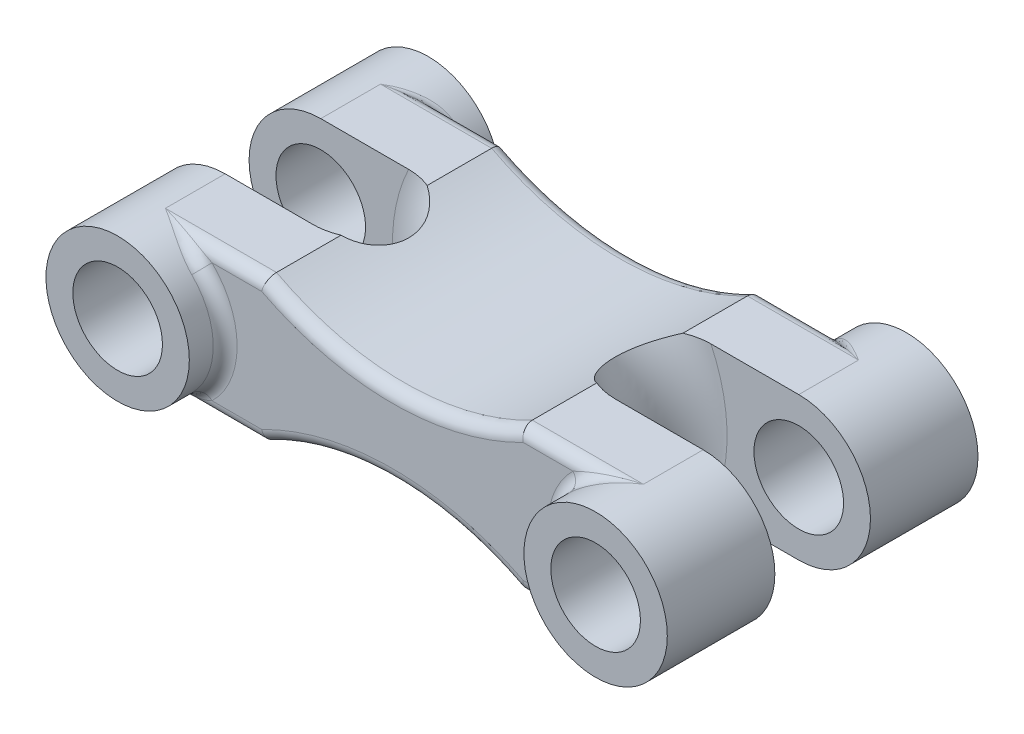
SolidWorks part; units mm, degrees
ref_plane "Front" through (0, 0, 0) normal (0, 0, 1) x (1, 0, 0)
ref_plane "Top" through (0, 0, 0) normal (0, 1, 0) x (1, 0, 0)
ref_plane "Right" through (0, 0, 0) normal (1, 0, 0) x (0, 0, -1)
sketch "Sketch1" plane through (0, 0, 0) normal (0, 0, 1) x (1, 0, 0)
  line L0 (0, 0) -> (400, 0) construction
  circle A0 centre (400, 0) radius 37.5
  circle A1 centre (0, 0) radius 37.5
  circle A2 centre (0, 0) radius 60
  circle A3 centre (400, 0) radius 60
  dimension "D2" = 75
  dimension "D3" = 75
  dimension "D4" = 22.5
  dimension "D1" = 400
extrude "Extrude1" add sketch "Sketch1" along normal mid plane 260
sketch "Sketch2" plane through (0, 0, 0) normal (0, 0, 1) x (1, 0, 0)
  line L5 (0, -60) -> (400, -60)
  line L6 (0, -60) -> (400, -60)
  line L7 (0, 60) -> (400, 60)
  line L8 (0, 60) -> (400, 60)
  circle A0 centre (400, 0) radius 60 construction
  circle A1 centre (0, 0) radius 60 construction
  arc A2 (400, 60) -> (400, -60) centre (400, 0) ccw
  arc A3 (0, -60) -> (0, 60) centre (0, 0) ccw
  dimension "D1" = 60
  dimension "D2" = 60
extrude "Extrude2" add sketch "Sketch2" along normal mid plane 200
sketch "Sketch3" plane through (0, 0, 0) normal (0, 0, 1) x (1, 0, 0)
  line L2 (0, 0) -> (400, 0) construction
  line L3 (0, 0) -> (400, 0) construction
  line L9 (0, -150) -> (400, -150)
  line L10 (0, -150) -> (400, -150)
  line L11 (0, 150) -> (400, 150)
  line L12 (0, 150) -> (400, 150)
  arc A0 (400, 150) -> (0, 150) centre (200, 263.5782) cw
  arc A1 (400, -150) -> (0, -150) centre (200, -263.5782) ccw
  dimension "D3" = 230
  dimension "D1" = 150
  dimension "D2" = 150
extrude "Cut-Extrude1" cut sketch "Sketch3" against normal mid plane 260
sketch "Sketch6" plane through (0, 0, 0) normal (0, 1, 0) x (1, 0, 0)
  line L2 (340, -40) -> (460, -40)
  line L3 (340, -40) -> (460, -40)
  line L4 (340, 40) -> (460, 40)
  line L5 (340, 40) -> (460, 40)
  line L8 (200, 0) -> (200, 252.9689) construction
  line L13 (0, 0) -> (400, 0) construction
  line L14 (200, 100) -> (200, -100) construction
  line L15 (460, -40) -> (460, 40)
  arc A0 (340, 40) -> (340, -40) centre (340, 0) ccw
  dimension "D1" = 40
  dimension "D2" = 40
revolve "Cut-Revolve2" cut sketch "Sketch6" angle 360 about L8
fillet "Fillet1" radius 10
